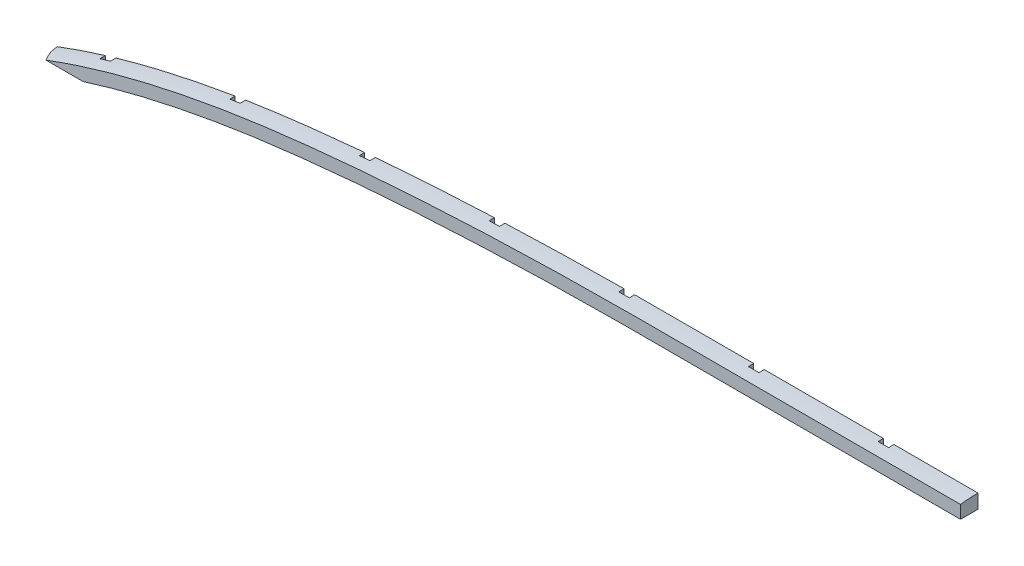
SolidWorks part; units mm, degrees
other "<0 Tail Flange Base Part Extended>-<#8-32 Tapped Hole1>"
ref_plane "Front Plane" through (0, 0, 0) normal (0, 0, 1) x (1, 0, 0)
ref_plane "Top Plane" through (0, 0, 0) normal (0, 1, 0) x (1, 0, 0)
ref_plane "Right Plane" through (0, 0, 0) normal (1, 0, 0) x (0, 0, -1)
mirrored part "0 Tail Flange Base Part Extended_Mirrored"
